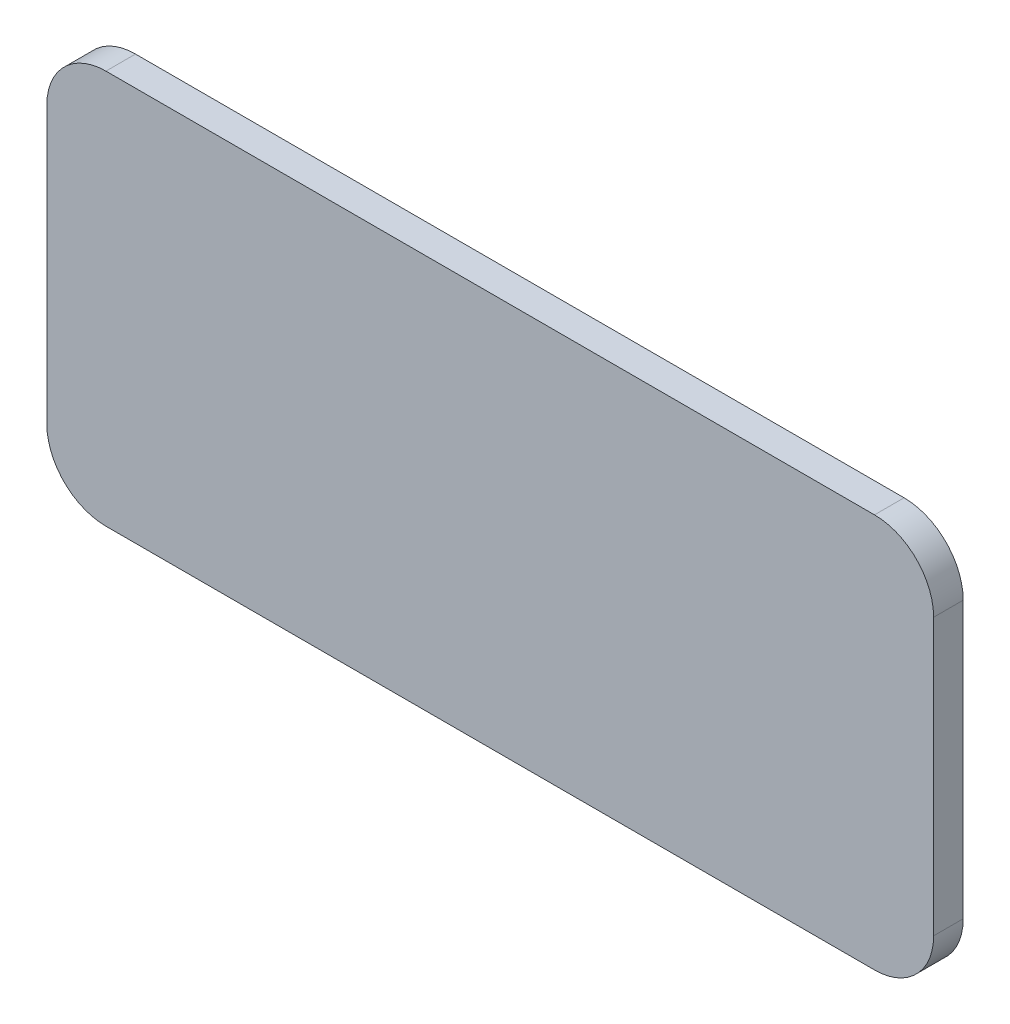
SolidWorks part; units mm, degrees
ref_plane "Alzado" through (0, 0, 0) normal (0, 0, 1) x (1, 0, 0)
ref_plane "Planta" through (0, 0, 0) normal (0, 1, 0) x (1, 0, 0)
ref_plane "Vista lateral" through (0, 0, 0) normal (1, 0, 0) x (0, 0, -1)
sketch "Croquis1" plane through (0, 0, 0) normal (0, 0, 1) x (1, 0, 0)
  line L8 (55, 34.5) -> (55, 20.5)
  line L9 (58, 17.5) -> (97, 17.5)
  line L10 (100, 20.5) -> (100, 34.5)
  line L11 (97, 37.5) -> (58, 37.5)
  arc A8 (55, 20.5) -> (58, 17.5) centre (58, 20.5) ccw
  arc A9 (97, 17.5) -> (100, 20.5) centre (97, 20.5) ccw
  arc A10 (100, 34.5) -> (97, 37.5) centre (97, 34.5) ccw
  arc A11 (58, 37.5) -> (55, 34.5) centre (58, 34.5) ccw
extrude "Saliente-Extruir1" add sketch "Croquis1" along normal blind 1.5
